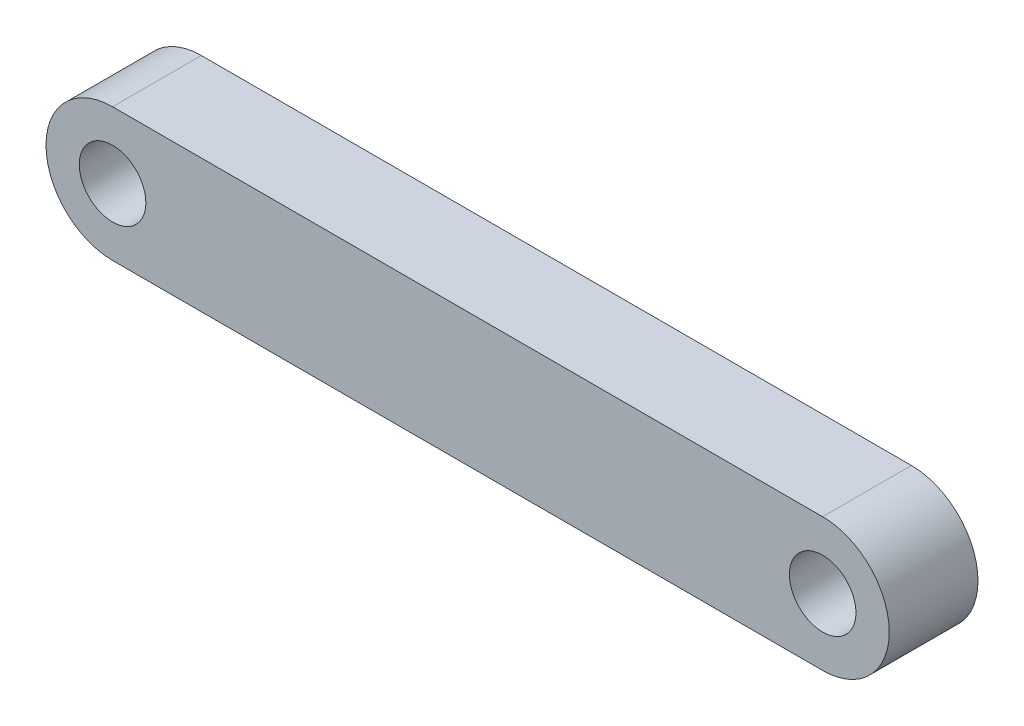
SolidWorks part; units mm, degrees
ref_plane "Plane1" through (0, 0, 0) normal (0, 0, 1) x (1, 0, 0)
ref_plane "Plane2" through (0, 0, 0) normal (0, 1, 0) x (1, 0, 0)
ref_plane "Plane3" through (0, 0, 0) normal (1, 0, 0) x (0, 0, -1)
sketch "Sketch1" plane through (0, 0, 0) normal (0, 0, 1) x (1, 0, 0)
  line L0 (0, 19.05) -> (203.2, 19.05)
  line L2 (203.2, -19.05) -> (0, -19.05)
  arc A0 (203.2, 19.05) -> (203.2, -19.05) centre (203.2, 0) cw
  arc A1 (0, 19.05) -> (0, -19.05) centre (0, 0) ccw
  circle A2 centre (203.2, 0) radius 9.525
  circle A3 centre (0, 0) radius 9.525
  dimension "D1" = 19.05
  dimension "D3" = 19.05
  dimension "D4" = 19.05
  dimension "D2" = 203.2
extrude "Base-Extrude" add sketch "Sketch1" along normal mid plane 25.4
